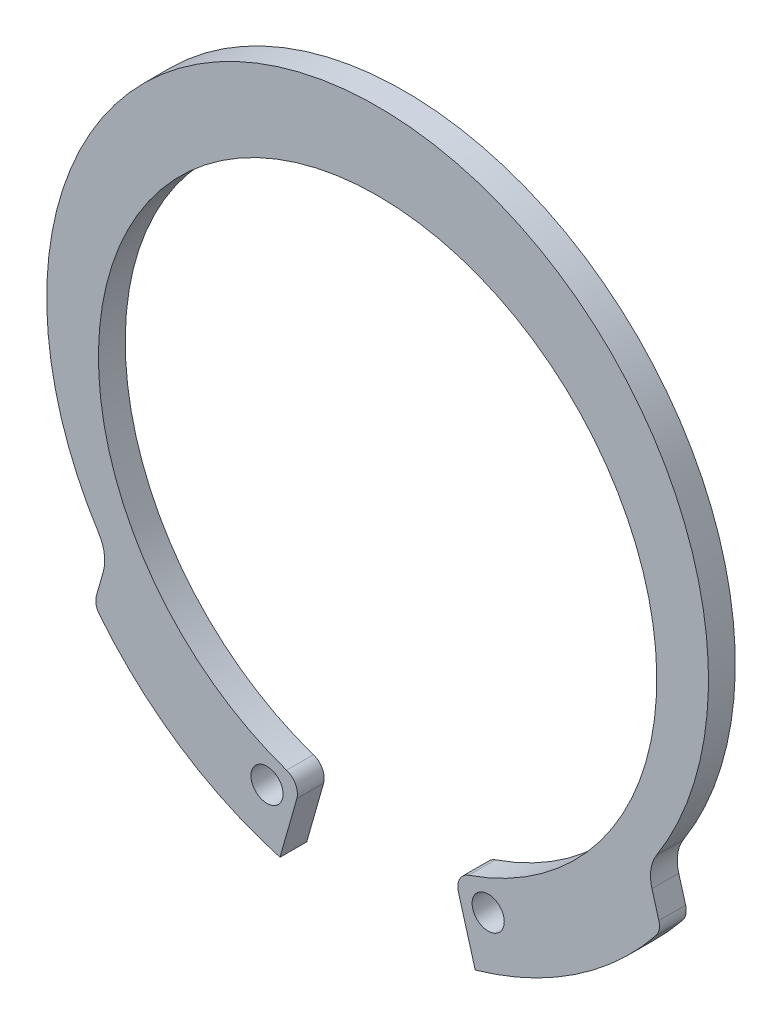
SolidWorks part; units mm, degrees
ref_plane "Plane1" through (0, 0, 0) normal (0, 0, 1) x (1, 0, 0)
ref_plane "Plane2" through (0, 0, 0) normal (0, 1, 0) x (1, 0, 0)
ref_plane "Plane3" through (0, 0, 0) normal (1, 0, 0) x (0, 0, -1)
sketch "Clipboard" plane through (0, 0, 0) normal (0, 0, 1) x (1, 0, 0)
  line L0 (0, 0) -> (1.7272, 0)
  line L1 (0, 0) -> (0, 0.9144)
  line L2 (0, 0) -> (0, -1.8288)
  circle A0 centre (0, 0) radius 0.381
  circle A1 centre (0, 0) radius 7.9375
  dimension "HoleDia" = 0.762
  dimension "BoreDia" = 15.875
  dimension "SmallSection" = 0.9144
  dimension "LugSection" = 1.8288
sketch "BodySke" plane through (0, 0, 0) normal (0, 0, 1) x (1, 0, 0)
  line L0 (0, 0) -> (0, 11.176) construction
  line L1 (0, 0) -> (10.8692, 0) construction
  line L2 (0, 0) -> (-7.3796, -4.1071) construction
  line L3 (0, 0) -> (7.3796, -4.1071) construction
  line L4 (-1.9145, -6.7199) -> (-2.314, -8.1223)
  line L5 (1.9145, -6.7199) -> (2.314, -8.1223)
  line L6 (6.502, -4.3571) -> (6.6655, -4.9312)
  line L7 (-6.502, -4.3571) -> (-6.6655, -4.9312)
  line L8 (-2.439, -6.1508) -> (-2.9421, -7.9165) construction
  line L9 (2.439, -6.1508) -> (2.9421, -7.9165) construction
  arc A0 (2.314, -8.1223) -> (6.5967, -5.2735) centre (0, 0) ccw
  arc A1 (-6.3587, -3.5389) -> (6.3587, -3.5389) centre (0, 0) ccw construction
  arc A2 (2.1567, -6.2553) -> (-2.1567, -6.2553) centre (0, 0) ccw
  arc A3 (-6.502, -4.3571) -> (-6.6104, -3.6161) centre (-7.3796, -4.1071) ccw
  arc A4 (6.6104, -3.6161) -> (6.502, -4.3571) centre (7.3796, -4.1071) ccw
  arc A5 (-6.5967, -5.2735) -> (-2.314, -8.1223) centre (0, 0) ccw
  arc A6 (6.5806, -3.6624) -> (-6.5806, -3.6624) centre (0, 0.6033) ccw construction
  arc A7 (6.6104, -3.6161) -> (-6.6104, -3.6161) centre (0, 0.6033) ccw
  circle A8 centre (0, 0) radius 8.4455 construction
  circle A9 centre (2.6208, -6.7888) radius 0.381
  circle A10 centre (-2.6208, -6.7888) radius 0.381
  arc A11 (-6.5967, -5.2735) -> (-6.6655, -4.9312) centre (-6.2991, -5.0356) cw
  arc A12 (-1.9145, -6.7199) -> (-2.1567, -6.2553) centre (-2.2809, -6.6155) ccw
  arc A13 (1.9145, -6.7199) -> (2.1567, -6.2553) centre (2.2809, -6.6155) cw
  arc A14 (6.5967, -5.2735) -> (6.6655, -4.9312) centre (6.2991, -5.0356) ccw
  dimension "GrooveDia" = 16.891
  dimension "HoleOffsetRad" = 7.2771
  dimension "HoleDia" = 0.762
  dimension "InsideDia" = 13.2334
  dimension "SmallRad" = 7.5311
  dimension "GapAngle" = 31.805
  dimension "LugAngle" = 121.805
  dimension "HoleOffset" = 0.6604
extrude "Body" add sketch "BodySke" against normal blind 0.635
equation "' \"BoreDia@Clipboard\" = 0.625"
equation "' \"Thickness@Body\" = 0.025"
equation "' \"GrooveDia@BodySke\" = 0.665"
equation "' \"LugSection@Clipboard\" = 0.072"
equation "' \"SmallSection@Clipboard\" = 0.036"
equation "' \"HoleDia@Clipboard\" = 0.03"
equation "' \"BoreDia@Clipboard\" = 0.75"
equation "' \"Thickness@Body\" = 0.035"
equation "' \"GrooveDia@BodySke\" = 0.796"
equation "' \"LugSection@Clipboard\" = 0.085"
equation "' \"SmallSection@Clipboard\" = 0.042"
equation "' \"HoleDia@Clipboard\" = 0.042"
equation "\"InsideDia@BodySke\" = \"GrooveDia@BodySke\" -  \"LugSection@Clipboard\" * 2"
equation "\"GapAngle@BodySke\" = 360 - 360 * 0.97 * ( \"BoreDia@Clipboard\" / \"GrooveDia@BodySke\" )"
equation "\"LugAngle@BodySke\" = \"GapAngle@BodySke\" + 90"
equation "\"SmallRad@BodySke\" =  \"InsideDia@BodySke\" / 2 +  \"SmallSection@Clipboard\""
equation "\"HoleOffsetRad@BodySke\" = (  \"BoreDia@Clipboard\" + \"InsideDia@BodySke\" ) / 4"
equation "\"HoleOffset@BodySke\" = \"HoleOffsetRad@BodySke\" - \"InsideDia@BodySke\" / 2"
equation "\"HoleDia@BodySke\" =  \"HoleDia@Clipboard\""
